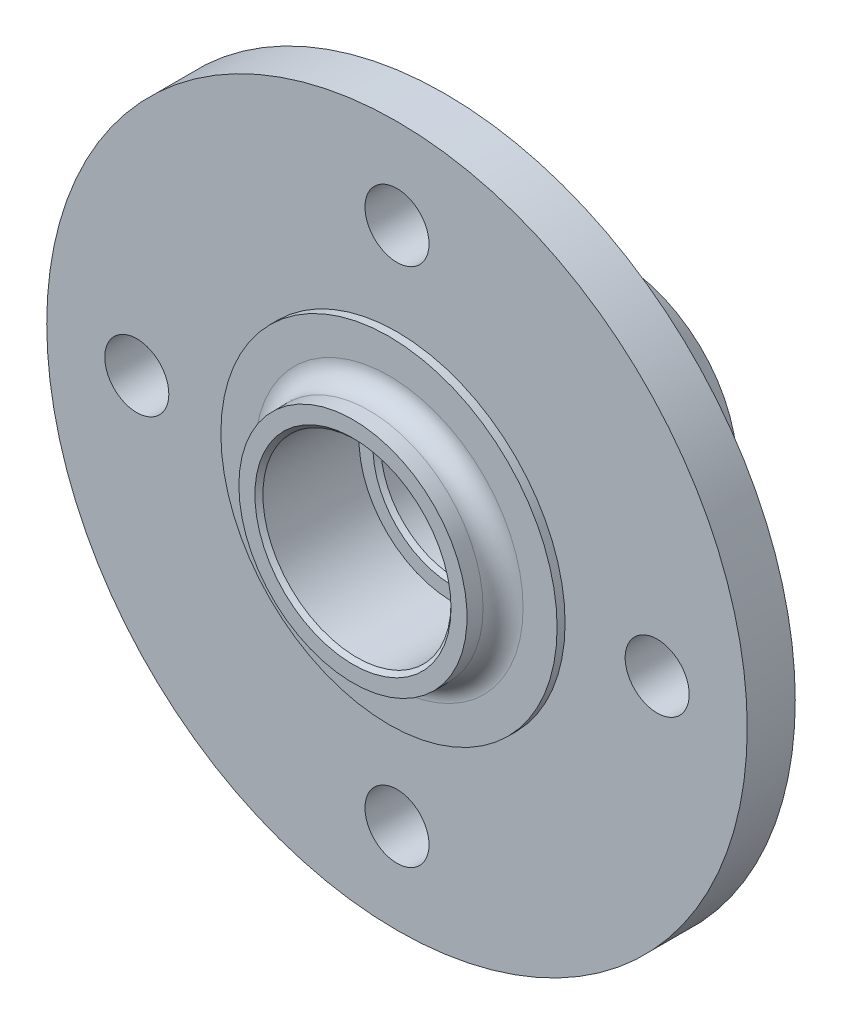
SolidWorks part; units mm, degrees
ref_plane "Plan de face" through (0, 0, 0) normal (0, 0, 1) x (1, 0, 0)
ref_plane "Plan de dessus" through (0, 0, 0) normal (0, 1, 0) x (1, 0, 0)
ref_plane "Plan de droite" through (0, 0, 0) normal (1, 0, 0) x (0, 0, -1)
sketch "Esquisse1" plane through (0, 0, 0) normal (0, 0, 1) x (1, 0, 0)
  circle A0 centre (0, 0) radius 87.5
  circle A1 centre (0, 65) radius 8
  circle A2 centre (65, 0) radius 8
  circle A3 centre (0, -65) radius 8
  circle A4 centre (-65, 0) radius 8
  dimension "D1" = 175
  dimension "D2" = 16
  dimension "D3" = 65
  dimension "D4" = 65
  dimension "D5" = 65
  dimension "D6" = 65
extrude "Extrusion1" add sketch "Esquisse1" against normal blind 12
sketch "Esquisse2" plane through (0, 0, 0) normal (0, 0, 1) x (1, 0, 0)
  circle A0 centre (0, 0) radius 42
  dimension "D1" = 84
extrude "Extrusion2" add sketch "Esquisse2" along normal blind 2
sketch "Esquisse3" plane through (0, 0, 2) normal (0, 0, 1) x (1, 0, 0)
  circle A0 centre (0, 0) radius 28.5
  dimension "D1" = 57
extrude "Extrusion3" add sketch "Esquisse3" along normal blind 9
sketch "Esquisse4" plane through (0, 0, 0) normal (1, 0, 0) x (0, 0, -1)
  line L0 (12, 40.2349) -> (42.133, 36)
  line L1 (12, -87.5) -> (12, 87.5) construction
  line L2 (42.133, 36) -> (55, 30)
  line L3 (55, 30) -> (55, 0)
  line L4 (55, 0) -> (12, 0)
  line L5 (12, -8) -> (12, 8) construction
  line L6 (12, 0) -> (12, 40.2349)
  line L7 (-27.1366, 0) -> (88.479, 0) construction
  dimension "D1" = 60
  dimension "D2" = 72
  dimension "D3" = 8
  dimension "D4" = 25
  dimension "D5" = 43
revolve "Révolution1" add sketch "Esquisse4" angle 360 about L7
fillet "Congé1" radius 5 2 edges at (28.5, 0, 2) (40.2349, 0, -12)
sketch "Esquisse5" plane through (0, 0, 11) normal (0, 0, 1) x (1, 0, 0)
  circle A0 centre (0, 0) radius 23.5
  dimension "D1" = 47
extrude "Enlèv. mat.-Extru.1" cut sketch "Esquisse5" against normal blind 25
sketch "Esquisse6" plane through (0, 0, -55) normal (0, 0, -1) x (-1, 0, 0)
  circle A0 centre (0, 0) radius 26
  dimension "D1" = 52
extrude "Enlèv. mat.-Extru.2" cut sketch "Esquisse6" against normal blind 28.5
sketch "Esquisse7" plane through (0, 0, -14) normal (0, 0, 1) x (1, 0, 0)
  circle A0 centre (0, 0) radius 19
  dimension "D1" = 38
extrude "Enlèv. mat.-Extru.3" cut sketch "Esquisse7" against normal through all
chamfer "Chanfrein1" distance 1 angle 45 4 edges at (23.5, 0, 11) (19, 0, -14) (-19, 0, -26.5) (-26, 0, -55)
